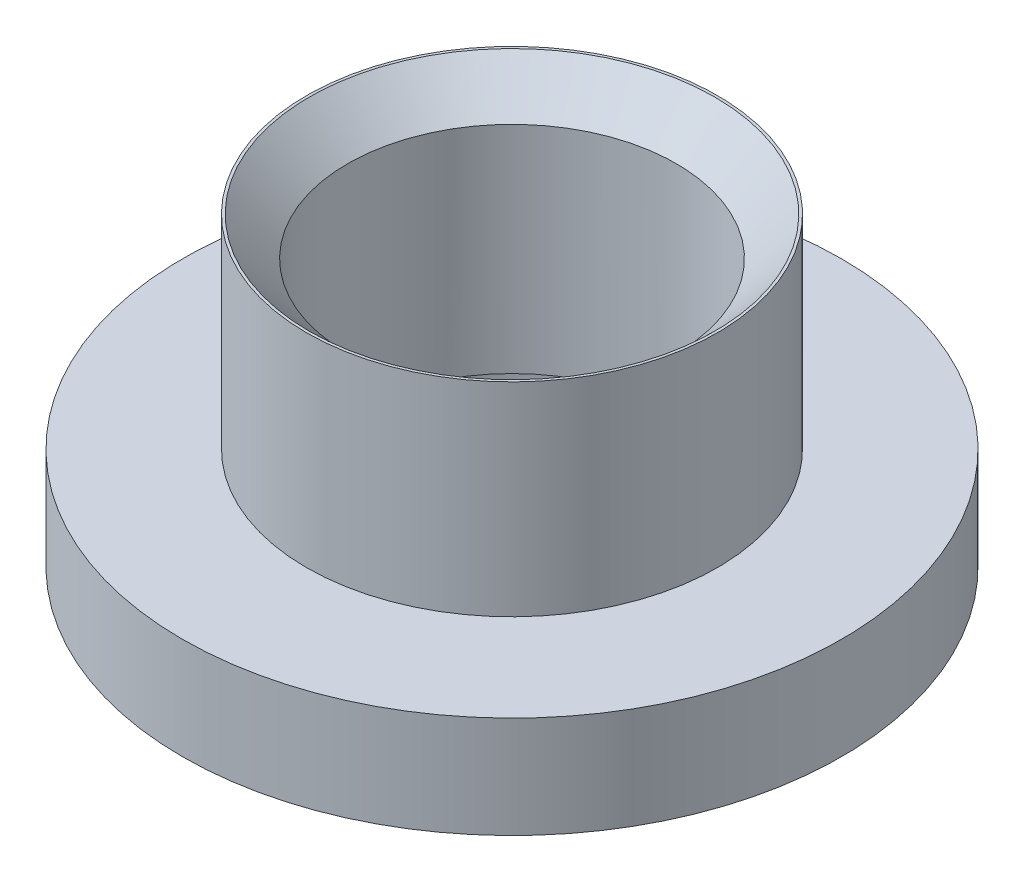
SolidWorks part; units mm, degrees
ref_plane "Front" through (0, 0, 0) normal (0, 0, 1) x (1, 0, 0)
ref_plane "Top" through (0, 0, 0) normal (0, 1, 0) x (1, 0, 0)
ref_plane "Right" through (0, 0, 0) normal (1, 0, 0) x (0, 0, -1)
sketch "Sketch1" plane through (0, 0, 0) normal (0, 1, 0) x (1, 0, 0)
  circle A0 centre (0, 0) radius 10.287
  dimension "D1" = 20.574
extrude "Extrude1" add sketch "Sketch1" along normal blind 9.525
sketch "Sketch2" plane through (0, 0, 0) normal (0, -1, 0) x (1, 0, 0)
  circle A0 centre (0, 0) radius 6.2992
  dimension "D1" = 12.5984
extrude "Extrude2" cut sketch "Sketch2" against normal blind 1.5875
sketch "Sketch5" plane through (0, 0, 0) normal (0, 0, 1) x (1, 0, 0)
  line L0 (0, 0) -> (0, -4.1425) construction
  line L1 (-16.1819, 24.0939) -> (-6.4135, 24.0939)
  line L2 (-16.1819, 24.0939) -> (-16.1819, 3.175)
  line L3 (-16.1819, 3.175) -> (-6.4135, 3.175)
  line L7 (10.287, 9.525) -> (-10.287, 9.525) construction
  line L24 (-6.4135, 3.175) -> (-6.4135, 24.0939)
  dimension "D1" = 12.827
  dimension "D4" = 6.35
revolve ".5dia" cut sketch "Sketch5" angle 360 about L0
sketch "Sketch4" plane through (0, 9.525, 0) normal (0, 1, 0) x (1, 0, 0)
  circle A0 centre (0, 0) radius 5.1308
  dimension "D1" = 10.2616
extrude "7/16-28 UNEF-2B" cut sketch "Sketch4" against normal through all
chamfer "Chamfer1-#2-011" distance 1.2001 angle 45 1 edges at (0, 9.525, 5.1308)
ref_plane "Plane1" through (0, 0, 0) normal (-1, 0, 0) x (0, 0, -1)
ref_plane "Plane2" through (0, 0, 0) normal (-1, 0, 0) x (0, 0, -1)
sketch "Sketch7" plane through (0, 0, 0) normal (-1, 0, 0) x (0, 0, -1)
  line L0 (7.7775, -1.0381) -> (7.6867, 0)
  line L1 (7.6867, 0) -> (10.0425, 0)
  line L2 (10.0425, 0) -> (9.9517, -1.0381)
  line L3 (9.6987, -1.27) -> (8.0305, -1.27)
  line L4 (0, 50) -> (0, -50) construction
  line L5 (9.9517, -1.0381) -> (9.9314, -1.27) construction
  line L6 (9.6987, -1.27) -> (9.9314, -1.27) construction
  line L7 (7.7775, -1.0381) -> (7.7978, -1.27) construction
  line L8 (8.0305, -1.27) -> (7.7978, -1.27) construction
  line L9 (10.287, 0) -> (-10.287, 0) construction
  arc A0 (9.9517, -1.0381) -> (9.6987, -1.27) centre (9.6987, -1.016) cw
  arc A1 (8.0305, -1.27) -> (7.7775, -1.0381) centre (8.0305, -1.016) cw
  dimension "D5" = 2.1336
  dimension "D6" = 0.254
  dimension "D7" = 0.254
  dimension "D1" = 15.5956
  dimension "D2" = 95
  dimension "D3" = 95
  dimension "D4" = 1.27
revolve "Groove for AS 568-016, O-Ring1" cut sketch "Sketch7"
equation "\"Buoyancy\"=\"SW-Volume\"*(\"SW-Density\"-.037062)"
